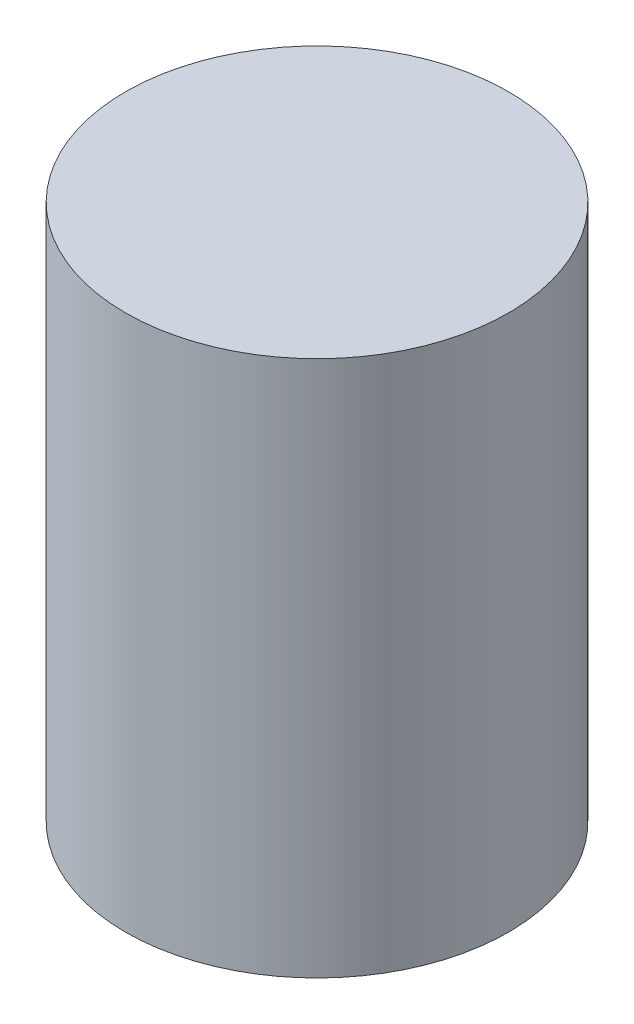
SolidWorks part; units mm, degrees
ref_plane "Front" through (0, 0, 0) normal (0, 0, 1) x (1, 0, 0)
ref_plane "Top" through (0, 0, 0) normal (0, 1, 0) x (1, 0, 0)
ref_plane "Right" through (0, 0, 0) normal (1, 0, 0) x (0, 0, -1)
sketch "Sketch1" plane through (0, 0, 0) normal (0, 1, 0) x (1, 0, 0)
  circle A0 centre (0, 0) radius 31.75
  dimension "D1" = 63.5
extrude "Extrude1" add sketch "Sketch1" along normal blind 88.9
